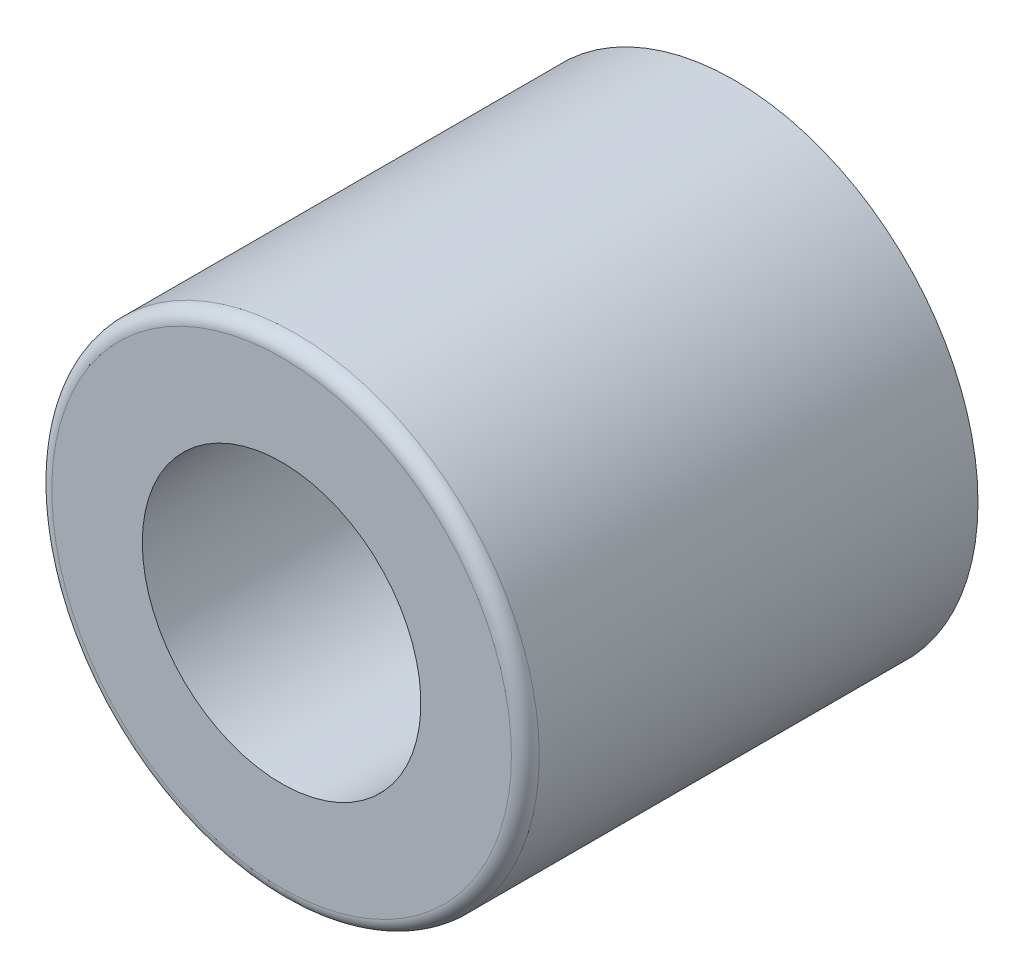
SolidWorks part; units mm, degrees
ref_plane "Plan1" through (0, 0, 0) normal (0, 0, 1) x (1, 0, 0)
ref_plane "Plan2" through (0, 0, 0) normal (0, 1, 0) x (1, 0, 0)
ref_plane "Plan3" through (0, 0, 0) normal (1, 0, 0) x (0, 0, -1)
sketch "Esquisse2" plane through (0, 0, 0) normal (0, 0, 1) x (1, 0, 0)
  circle A0 centre (0, 0) radius 3.5
  circle A1 centre (0, 0) radius 2
  dimension "D1" = 7
  dimension "D2" = 4
extrude "Base-Extrusion" add sketch "Esquisse2" along normal blind 6.5
fillet "Congé1" radius 0.2
